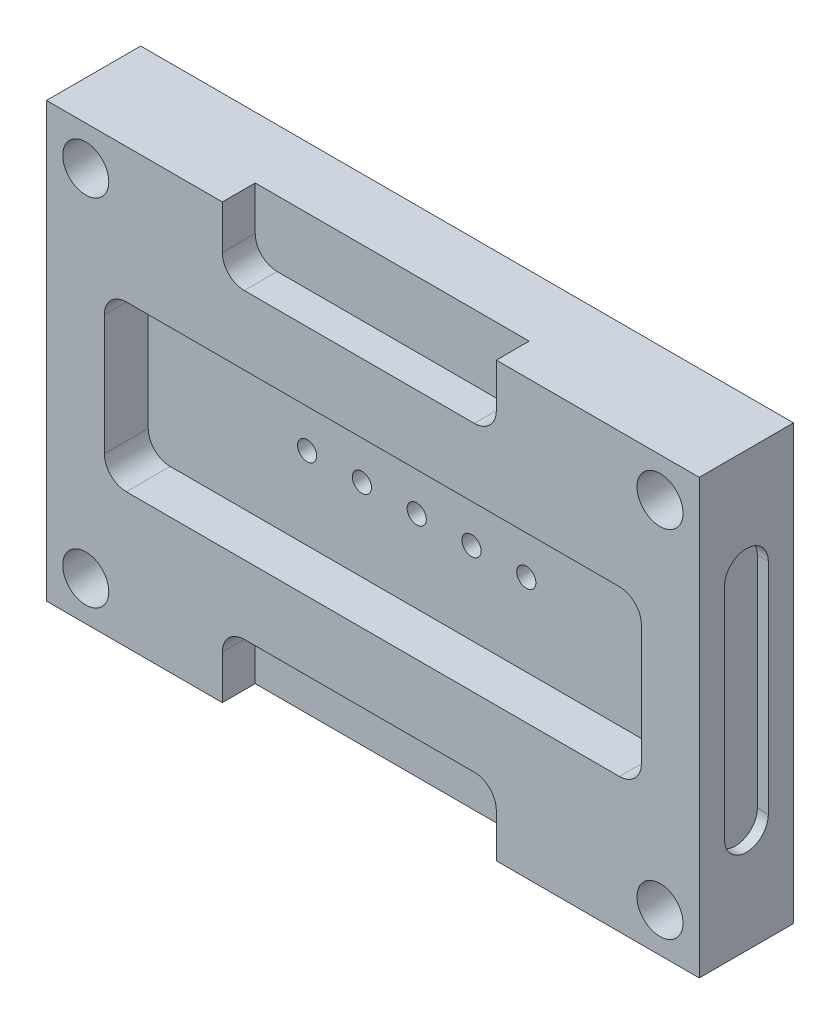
SolidWorks part; units mm, degrees
ref_plane "Plane1" through (0, 0, 0) normal (0, 0, 1) x (1, 0, 0)
ref_plane "Plane2" through (0, 0, 0) normal (0, 1, 0) x (1, 0, 0)
ref_plane "Plane3" through (0, 0, 0) normal (1, 0, 0) x (0, 0, -1)
sketch "Sketch1" plane through (0, 0, 0) normal (0, 0, 1) x (1, 0, 0)
  line L0 (-297.85, 197.85) -> (297.85, 197.85)
  line L1 (-297.85, 197.85) -> (-297.85, -197.85)
  line L2 (297.85, -197.85) -> (-297.85, -197.85)
  line L3 (297.85, -197.85) -> (297.85, 197.85)
extrude "Base-Extrude" add sketch "Sketch1" along normal blind 86
other "Guide1"
sketch "Guide1ctrl" plane through (0, 0, 86) normal (0, 0, 1) x (1, 0, 0)
  circle A0 centre (262, -162) radius 21
sketch "Guide2ctrl" plane through (-198.9733, 14.8462, 86) normal (0, 0, 1) x (1, 0, 0)
  circle A0 centre (-63.0267, -176.8462) radius 21
other "Guide2"
sketch "Guide3ctrl" plane through (-202.7593, 175.9032, 86) normal (0, 0, 1) x (1, 0, 0)
  circle A0 centre (-59.2407, -13.9032) radius 21
other "Guide3"
sketch "Guide4ctrl" plane through (-6.623, 178.3354, 86) normal (0, 0, 1) x (1, 0, 0)
  circle A0 centre (268.623, -16.3354) radius 21
other "Guide4"
sketch "Sketch2" plane through (0, 0, 86) normal (0, 0, 1) x (1, 0, 0)
  line L1 (-225, -75) -> (225, -75)
  line L2 (-245, -55) -> (-245, 55)
  line L3 (-225, 75) -> (225, 75)
  line L4 (245, -55) -> (245, 55)
  line L5 (-245, -75) -> (245, 75) construction
  line L6 (-245, 75) -> (245, -75) construction
  arc A0 (-245, 55) -> (-225, 75) centre (-225, 55) cw
  arc A1 (-225, -75) -> (-245, -55) centre (-225, -55) cw
  arc A2 (225, -75) -> (245, -55) centre (225, -55) ccw
  arc A3 (225, 75) -> (245, 55) centre (225, 55) cw
  point P0 (0, 0)
  dimension "D3" = 20
  dimension "D1" = 490
  dimension "D2" = 150
extrude "Extrude1" cut sketch "Sketch2" against normal blind 40
ref_plane "Plane4" through (-50, 0, 0) normal (1, 0, 0) x (0, 0, -1)
sketch "Sketch8" plane through (0, 0, 86) normal (0, 0, 1) x (1, 0, 0)
  line L0 (-297.85, 0) -> (297.85, 0) construction
  line L1 (-297.85, 197.85) -> (-297.85, -197.85) construction
  line L2 (297.85, -197.85) -> (297.85, 197.85) construction
  line L3 (0, -197.85) -> (0, 197.85) construction
  line L4 (297.85, -197.85) -> (-297.85, -197.85) construction
  line L5 (-297.85, 197.85) -> (297.85, 197.85) construction
  line L6 (-137.3616, -197.85) -> (112.6384, -197.85)
  line L8 (112.6384, -197.85) -> (112.6384, -157.85)
  line L9 (92.6384, -137.85) -> (-117.3616, -137.85)
  line L10 (-137.3616, -197.85) -> (-137.3616, -157.85)
  line L11 (0, -197.85) -> (-137.3616, -137.85) construction
  line L12 (112.6384, -137.85) -> (0, -197.85) construction
  line L13 (-137.3616, 197.85) -> (112.6384, 197.85)
  line L14 (-137.3616, 197.85) -> (-137.3616, 157.85)
  line L15 (92.6384, 137.85) -> (-117.3616, 137.85)
  line L16 (112.6384, 197.85) -> (112.6384, 157.85)
  arc A0 (112.6384, -157.85) -> (92.6384, -137.85) centre (92.6384, -157.85) ccw
  arc A1 (-117.3616, -137.85) -> (-137.3616, -157.85) centre (-117.3616, -157.85) ccw
  arc A2 (-117.3616, 137.85) -> (-137.3616, 157.85) centre (-117.3616, 157.85) cw
  arc A3 (112.6384, 157.85) -> (92.6384, 137.85) centre (92.6384, 157.85) cw
  dimension "D3" = 20
  dimension "D1" = 60
  dimension "D2" = 250
extrude "Cut-Extrude1" cut sketch "Sketch8" against normal blind 30
sketch "Sketch9" plane through (297.85, 0, 0) normal (1, 0, 0) x (0, 0, -1)
  line L0 (-43, -197.85) -> (-43, 197.85) construction
  line L1 (-86, -197.85) -> (0, -197.85) construction
  line L2 (-86, 197.85) -> (0, 197.85) construction
  line L3 (-43, -100) -> (-43, 100) construction
  line L4 (-63, -100) -> (-63, 100)
  line L5 (-23, -100) -> (-23, 100)
  arc A0 (-63, -100) -> (-23, -100) centre (-43, -100) ccw
  arc A1 (-23, 100) -> (-63, 100) centre (-43, 100) ccw
  point P8 (-43, 0)
  dimension "D2" = 20
  dimension "D1" = 200
extrude "Cut-Extrude2" cut sketch "Sketch9" against normal blind 10
hole_wizard "M16 Clearance Hole1" positions "Sketch12" profile "Sketch11" hole size "M16" standard "ANSI Metric"
sketch "Sketch12" plane through (0, 0, 46) normal (0, 0, 1) x (1, 0, 0)
  point P0 (0, 0)
  point P3 (-50, 0)
  point P5 (-100, 0)
  point P7 (50, 0)
  point P9 (100, 0)
  dimension "D1" = 50
  dimension "D2" = 50
  dimension "D3" = 50
  dimension "D4" = 50
sketch "Sketch11" plane through (0, 0, 46) normal (1, 0, 0) x (0, -1, 0)
  line L0 (0, 0) -> (0, 46)
  line L1 (0, 46) -> (8.75, 46)
  line L2 (8.75, 46) -> (8.75, 0)
  line L5 (8.75, 0) -> (0, 0)
  line L11 (0, -6.35) -> (0, 107.95) construction
  dimension "Thru Hole Dia." = 17.5
  dimension "Thru Hole Depth" = 46
equation "\"D3@Sketch1\" = \"l@Sketch1\" / 2"
equation "\"D4@Sketch1\" = \"b@Sketch1\" / 2"
